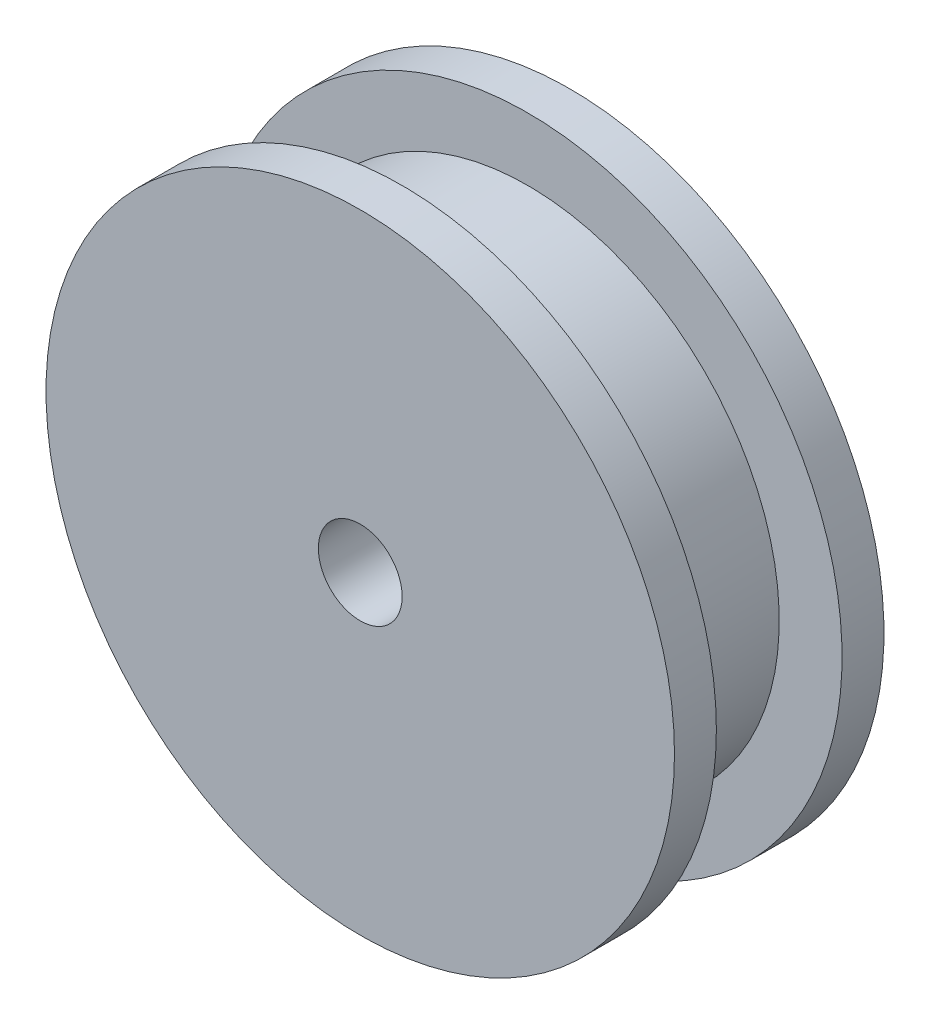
SolidWorks part; units mm, degrees
ref_plane "Front" through (0, 0, 0) normal (0, 0, 1) x (1, 0, 0)
ref_plane "Top" through (0, 0, 0) normal (0, 1, 0) x (1, 0, 0)
ref_plane "Right" through (0, 0, 0) normal (1, 0, 0) x (0, 0, -1)
sketch "Sketch1" plane through (0, 0, 0) normal (0, 0, 1) x (1, 0, 0)
  circle A0 centre (0, 0) radius 76.2
  dimension "D1" = 152.4
extrude "Extrude1" add sketch "Sketch1" along normal mid plane 38.1
sketch "Sketch2" plane through (0, 0, 19.05) normal (0, 0, 1) x (1, 0, 0)
  circle A2 centre (0, 0) radius 95.25
  circle A3 centre (0, 0) radius 95.25
  dimension "D1" = 19.05
extrude "Extrude2" add sketch "Sketch2" along normal blind 12.7
sketch "Sketch3" plane through (0, 0, -19.05) normal (0, 0, -1) x (-1, 0, 0)
  circle A2 centre (0, 0) radius 95.25
  circle A3 centre (0, 0) radius 95.25
  dimension "D1" = 19.05
extrude "Extrude3" add sketch "Sketch3" along normal blind 12.7
sketch "Sketch4" plane through (0, 0, 31.75) normal (0, 0, 1) x (1, 0, 0)
  circle A0 centre (0, 0) radius 12.7
  dimension "D1" = 25.4
extrude "Cut-Extrude1" cut sketch "Sketch4" against normal through all
